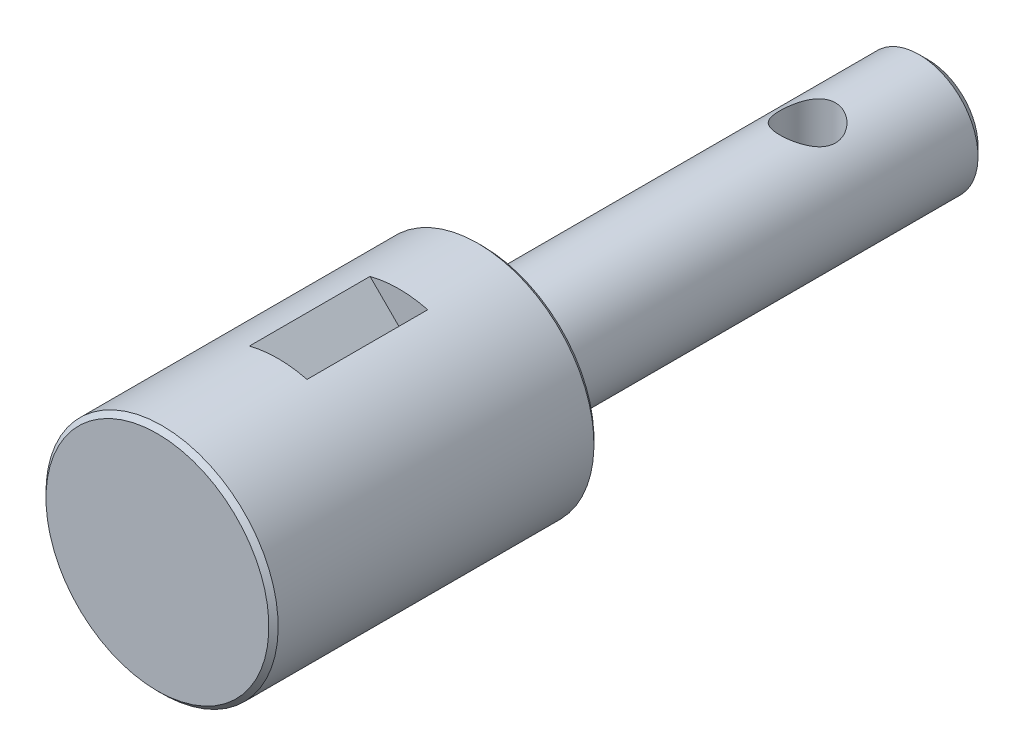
SolidWorks part; units mm, degrees
ref_plane "Спереди" through (0, 0, 0) normal (0, 0, 1) x (1, 0, 0)
ref_plane "Сверху" through (0, 0, 0) normal (0, 1, 0) x (1, 0, 0)
ref_plane "Справа" through (0, 0, 0) normal (1, 0, 0) x (0, 0, -1)
sketch "Эскиз1" plane through (0, 0, 0) normal (1, 0, 0) x (0, 0, -1)
  line L0 (0, 0) -> (0, 12)
  line L1 (0.5, 12.5) -> (0, 12)
  line L2 (0.5, 12.5) -> (34.5, 12.5)
  line L3 (35, 12) -> (34.5, 12.5)
  line L4 (35, 12) -> (35, 6.35)
  line L5 (35, 6.35) -> (82, 6.35)
  line L6 (83, 5.35) -> (83, 0)
  line L7 (83, 0) -> (0, 0)
  line L8 (82, 6.35) -> (83, 5.35)
  point P8 (83, 6.35)
  dimension "D1" = 83
  dimension "D2" = 6.35
  dimension "D3" = 12.5
  dimension "D4" = 45
  dimension "D5" = 45
  dimension "D6" = 0.5
  dimension "D7" = 35
  dimension "D10" = 1
revolve "Повернуть1" add sketch "Эскиз1" angle 360 about L7
ref_plane "Плоскость1" through (0, 0, -13) normal (0, 0, 1) x (1, 0, 0)
sketch "Эскиз2" plane through (0, 0, -13) normal (0, 0, 1) x (1, 0, 0)
  line L0 (0, 14.9555) -> (0, 0) construction
  line L1 (-3.8534, 12.8534) -> (3.8534, 12.8534)
  line L2 (3.8534, 12.8534) -> (0, 9)
  line L3 (0, 9) -> (-3.8534, 12.8534)
  line L4 (-5.1057, 12.5) -> (5.9448, 12.5) construction
  circle A0 centre (0, 0) radius 12.5 construction
  dimension "D1" = 90
  dimension "D2" = 3.5
extrude "Вырез-Вытянуть1" cut sketch "Эскиз2" against normal blind 13
sketch "Эскиз3" plane through (0, 0, 0) normal (0, 1, 0) x (1, 0, 0)
  line L0 (12, 35) -> (-12, 35) construction
  circle A0 centre (0, 70) radius 3
  dimension "D1" = 6
  dimension "D2" = 35
extrude "Вырез-Вытянуть2" cut sketch "Эскиз3" against normal mid plane 20
